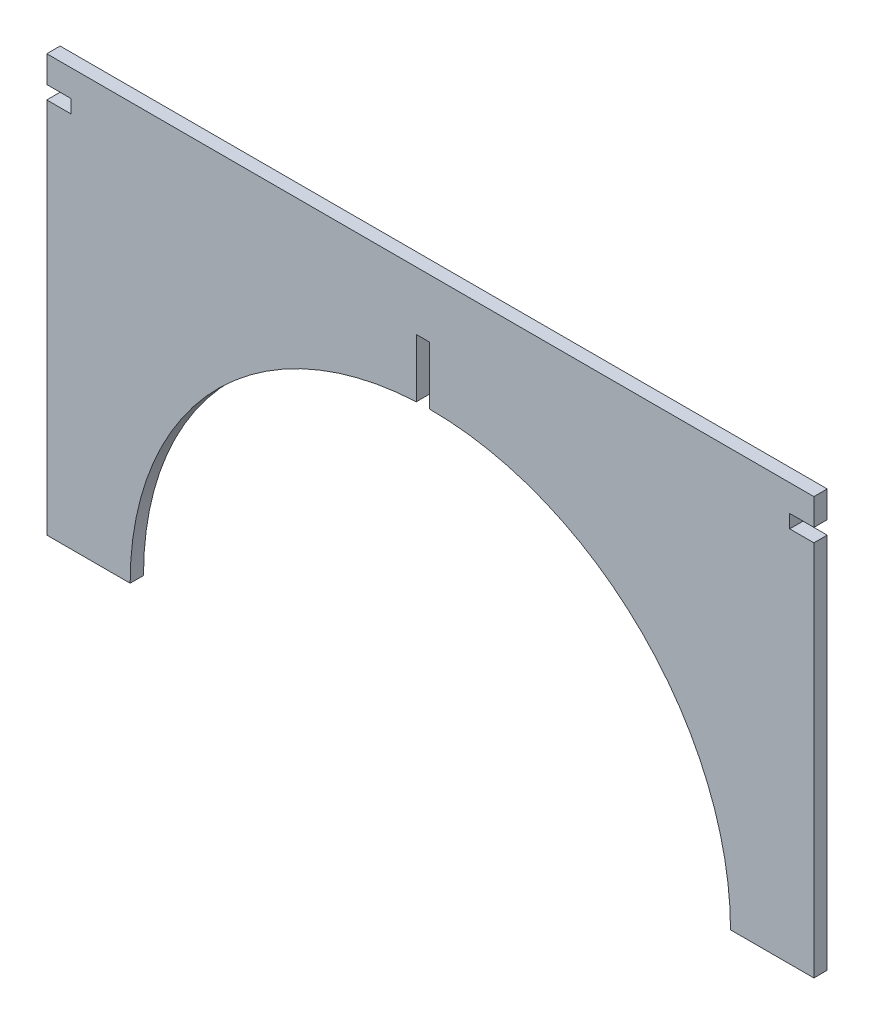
SolidWorks part; units mm, degrees
ref_plane "Front Plane" through (0, 0, 0) normal (0, 0, 1) x (1, 0, 0)
ref_plane "Top Plane" through (0, 0, 0) normal (0, 1, 0) x (1, 0, 0)
ref_plane "Right Plane" through (0, 0, 0) normal (1, 0, 0) x (0, 0, -1)
sketch "Sketch3" plane through (0, 0, 0) normal (0, 0, 1) x (1, 0, 0)
  line L1 (-672.6426, 353.8218) -> (247.3574, 353.8218)
  line L2 (-672.6426, 353.8218) -> (-672.6426, -146.1782)
  line L3 (-672.6426, -146.1782) -> (-572.6426, -146.1782)
  line L4 (247.3574, 353.8218) -> (247.3574, -146.1782)
  line L6 (147.3574, -146.1782) -> (247.3574, -146.1782)
  line L8 (-229.4976, 283.8218) -> (-213.4976, 283.8218)
  line L9 (-229.4976, 283.8218) -> (-229.4976, 213.8218)
  line L11 (-213.4976, 283.8218) -> (-213.4976, 214.2156)
  arc A0 (147.3574, -146.1782) -> (-213.4976, 214.2156) centre (-212.6426, -145.7836) ccw
  arc A2 (-229.4976, 213.8218) -> (-572.6426, -146.1782) centre (-212.6426, -145.7836) ccw
  point P0 (0, 0)
  point P12 (0, -7.2517)
  point P22 (-212.6426, 353.8218)
extrude "Boss-Extrude1" add sketch "Sketch3" along normal blind 16
sketch "Sketch5" plane through (0, 0, 16) normal (0, 0, 1) x (1, 0, 0)
  line L0 (247.3574, 353.8218) -> (-672.6426, 353.8218) construction
  line L1 (218.3574, 321.8218) -> (247.3574, 321.8218)
  line L2 (218.3574, 321.8218) -> (218.3574, 305.8218)
  line L3 (218.3574, 305.8218) -> (247.3574, 305.8218)
  line L4 (247.3574, 321.8218) -> (247.3574, 305.8218)
  line L5 (-672.6426, 353.8218) -> (-672.6426, -146.1782) construction
  line L6 (-672.6426, 321.8218) -> (-643.6426, 321.8218)
  line L7 (247.3574, -146.1782) -> (247.3574, 353.8218) construction
  line L8 (-672.6426, 321.8218) -> (-672.6426, 305.8218)
  line L9 (-672.6426, 305.8218) -> (-643.6426, 305.8218)
  line L10 (-643.6426, 321.8218) -> (-643.6426, 305.8218)
  point P0 (239.3574, 329.8218)
  point P5 (232.8574, 321.8218)
  point P8 (-672.6426, 313.8218)
  point P13 (-664.6426, 329.8218)
  dimension "D1" = 32
  dimension "D2" = 16
  dimension "D3" = 29
  dimension "D4" = 0
  dimension "D5" = 32
  dimension "D6" = 0
  dimension "D7" = 29
  dimension "D8" = 16
extrude "Cut-Extrude3" cut sketch "Sketch5" against normal blind 16
equation "\"thicknes\"= 16mm"
equation "\"press\"= 16mm"
equation "\"D5@Sketch3\"=\"press\""
